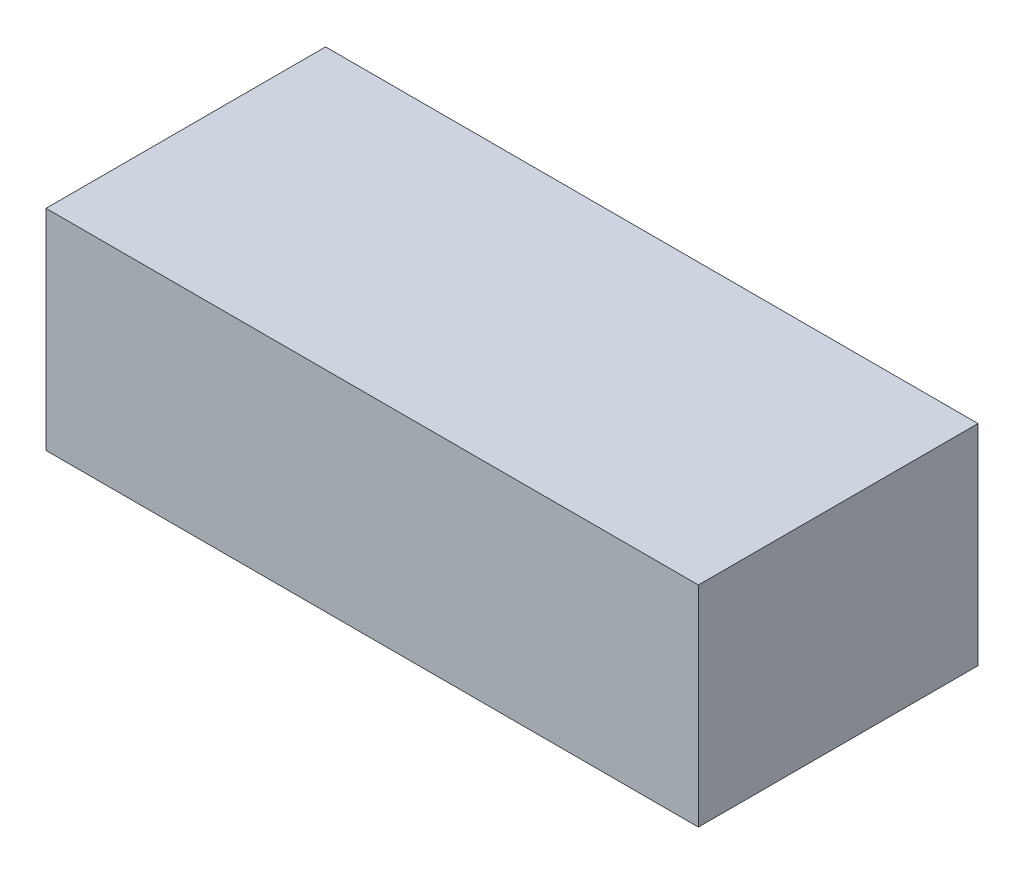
SolidWorks part; units mm, degrees
ref_plane "Front Plane" through (0, 0, 0) normal (0, 0, 1) x (1, 0, 0)
ref_plane "Top Plane" through (0, 0, 0) normal (0, 1, 0) x (1, 0, 0)
ref_plane "Right Plane" through (0, 0, 0) normal (1, 0, 0) x (0, 0, -1)
sketch "Sketch1" plane through (0, 0, 0) normal (0, 0, 1) x (1, 0, 0)
  line L1 (-700, -225) -> (700, -225)
  line L2 (-700, -225) -> (-700, 225)
  line L3 (-700, 225) -> (700, 225)
  line L4 (700, -225) -> (700, 225)
extrude "Boss-Extrude1" add sketch "Sketch1" against normal blind 600
sketch "Sketch2" plane through (0, 0, 0) normal (0, 0, 1) x (1, 0, 0)
  circle A0 centre (-350, 0) radius 120
  circle A1 centre (350, 0) radius 120
extrude "Boss-Extrude2" add sketch "Sketch2" against normal blind 150
